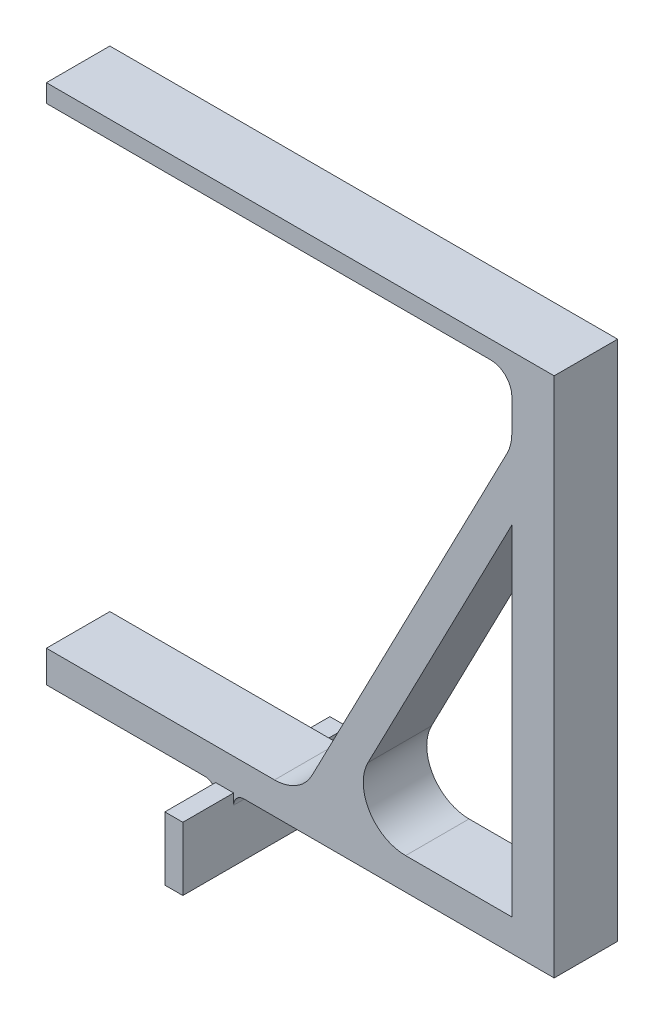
SolidWorks part; units mm, degrees
ref_plane "Front Plane" through (0, 0, 0) normal (0, 0, 1) x (1, 0, 0)
ref_plane "Top Plane" through (0, 0, 0) normal (0, 1, 0) x (1, 0, 0)
ref_plane "Right Plane" through (0, 0, 0) normal (1, 0, 0) x (0, 0, -1)
sketch "Sketch1" plane through (0, 0, 0) normal (0, 0, 1) x (1, 0, 0)
  line L2 (0, 3) -> (0, 0)
  line L3 (0, 0) -> (0.85, 0)
  line L4 (0.85, 3) -> (0.85, 0)
  line L5 (-4, 4.5) -> (4, 4.5)
  line L7 (0.85, 3) -> (16, 3)
  line L10 (16, 3) -> (16, 27.65)
  line L12 (14, 4.5) -> (14, 20.5395)
  line L13 (14, 27.65) -> (-8, 27.65)
  line L15 (14, 26.8) -> (-8, 26.8)
  line L16 (-8, 27.65) -> (-8, 26.8)
  line L17 (14, 27.65) -> (16, 27.65)
  line L18 (14, 23.8) -> (4, 4.5)
  line L19 (5.6894, 4.5) -> (14, 20.5395)
  line L20 (5.6894, 4.5) -> (14, 4.5)
  line L21 (14, 23.8) -> (14, 26.8)
  line L25 (0, 3) -> (-4, 3)
  line L26 (-4, 4.5) -> (-4, 3)
  dimension "D1" = 0.85
  dimension "D2" = 1.5
  dimension "D3" = 3
  dimension "D4" = 23.8
  dimension "D5" = 0.85
  dimension "D6" = 22
  dimension "D7" = 2
  dimension "D8" = 8
  dimension "D9" = 1.5
  dimension "D10" = 18
  dimension "D11" = 3
  dimension "D12" = 4
extrude "Boss-Extrude1" add sketch "Sketch1" along normal blind 3
fillet "Fillet1" radius 2 3 edges at (14, 23.8, 1.5) (4, 4.5, 1.5) (5.6894, 4.5, 1.5)
fillet "Fillet2" radius 1 1 edges at (14, 26.8, 1.5)
sketch "Sketch2" plane through (0, 0, 3) normal (0, 0, 1) x (1, 0, 0)
  line L1 (0, 0) -> (0.85, 0)
  line L2 (0, 0) -> (0, 3)
  line L3 (0, 3) -> (0.85, 3)
  line L4 (0.85, 0) -> (0.85, 3)
extrude "Boss-Extrude2" add sketch "Sketch2" along normal blind 2.4 and the other way blind 5.4
fillet "Fillet3" radius 0.5 2 edges at (0, 3, 1.5) (0.85, 3, 1.5)
sketch "Sketch3" plane through (-4, 0, 0) normal (-1, 0, 0) x (0, 0, 1)
  line L1 (0, 3) -> (3, 3)
  line L2 (0, 3) -> (0, 4.5)
  line L3 (0, 4.5) -> (3, 4.5)
  line L4 (3, 3) -> (3, 4.5)
extrude "Boss-Extrude3" add sketch "Sketch3" along normal blind 4
